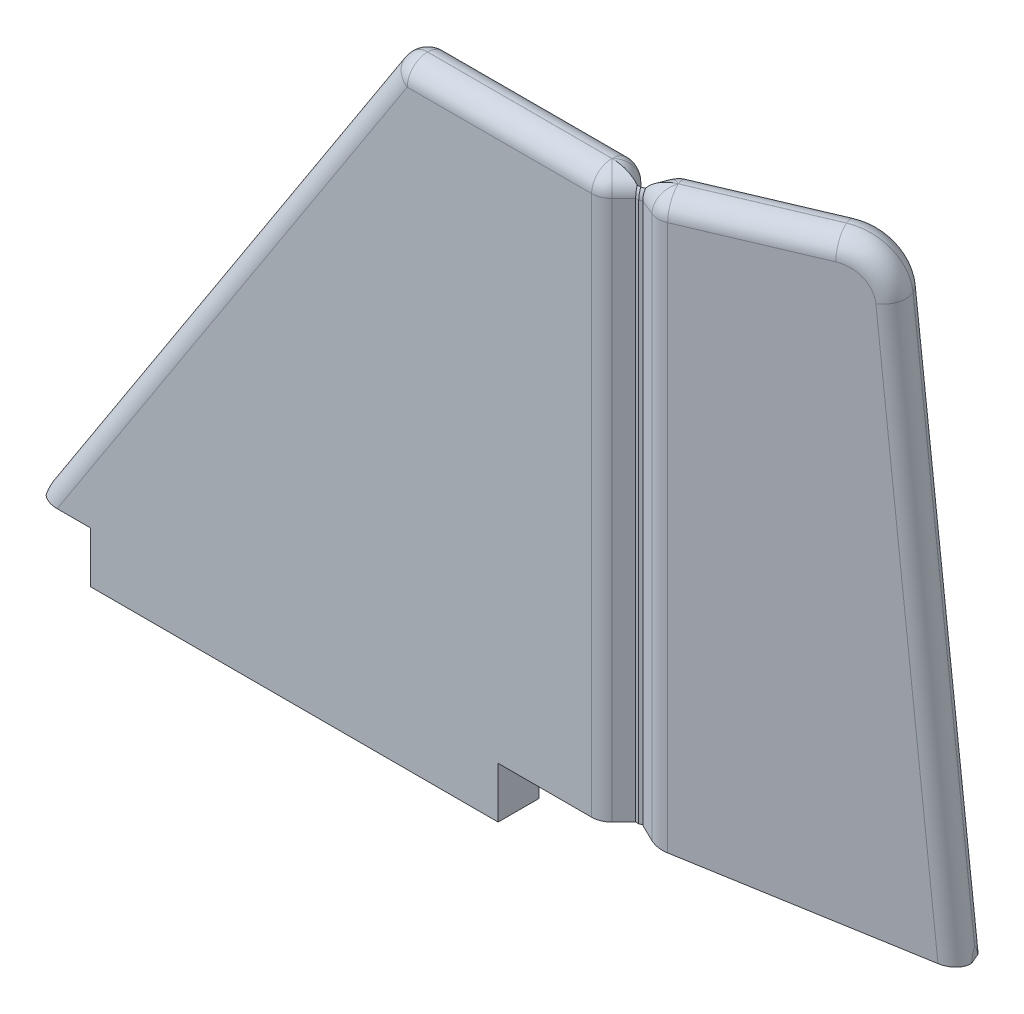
SolidWorks part; units mm, degrees
ref_plane "Plan de face" through (0, 0, 0) normal (0, 0, 1) x (1, 0, 0)
ref_plane "Plan de dessus" through (0, 0, 0) normal (0, 1, 0) x (1, 0, 0)
ref_plane "Plan de droite" through (0, 0, 0) normal (1, 0, 0) x (0, 0, -1)
sketch "Esquisse1" plane through (0, 0, 0) normal (0, 1, 0) x (1, 0, 0)
  line L0 (-66.7162, 0) -> (100.1965, 0) construction
  line L1 (0, -23.9494) -> (0, 66.7162) construction
  line L2 (-57, -25.2419) -> (-57, 46.6455) construction
  line L3 (0, 0) -> (41.9034, 17.787) construction
  line L4 (17.2106, 23.4369) -> (32.8573, -13.4244) construction
  line L5 (8.1991, -19.3158) -> (0, 0) construction
  line L6 (-61.3571, -2) -> (-0.9216, -2) construction
  line L7 (36.5036, 13.3221) -> (1.4959, -1.5377) construction
  line L8 (-61.3571, 2) -> (-0.9216, 2) construction
  line L9 (0.3188, 2.3081) -> (35.6525, 17.3063) construction
  line L10 (1.0043, 0.6979) -> (-0.0509, 0.25) construction
  line L11 (1.3069, 0.2831) -> (0.0509, -0.25) construction
  line L12 (-2.3707, 0.25) -> (-0.0509, 0.25) construction
  line L13 (-2.3707, -0.25) -> (0.0509, -0.25) construction
  line L14 (0.8641, -1.3958) -> (-0.1421, 0.9746) construction
  line L15 (-0.25, -0.25) -> (-2.4272, -2.4272) construction
  line L16 (-0.25, 0.4022) -> (-0.25, -0.7324) construction
  line L17 (0.3278, -0.1324) -> (3.0113, -1.2166) construction
  line L18 (2.6225, -1.0595) -> (0.3278, -0.1324)
  line L19 (0.3278, -0.1324) -> (0.0509, -0.25)
  line L20 (1.0595, 2.6225) -> (0.1324, 0.3278)
  line L21 (-0.25, -0.25) -> (-2, -2)
  line L22 (-0.25, 0.25) -> (-2, 2)
  line L23 (-0.25, -0.25) -> (0.0509, -0.25)
  line L24 (-0.25, 0.25) -> (-0.0509, 0.25)
  line L25 (-0.0509, 0.25) -> (0.1324, 0.3278)
  line L26 (1.0595, 2.6225) -> (22.2312, 11.6093)
  line L27 (22.2312, 11.6093) -> (23.7941, 7.9273)
  line L28 (23.7941, 7.9273) -> (2.6225, -1.0595)
  line L29 (-2, -2) -> (-57, -2)
  line L30 (-57, -2) -> (-57, 2)
  line L31 (-57, 2) -> (-2, 2)
  dimension "D1" = 157
  dimension "D2" = 57
  dimension "D3" = 0.5
  dimension "D4" = 2
  dimension "D5" = 4
  dimension "D6" = 2
  dimension "D7" = 0.5
  dimension "D8" = 0.25
  dimension "D9" = 0.25
  dimension "D10" = 0.25
  dimension "D11" = 0.25
  dimension "D12" = 45
  dimension "D13" = 45
extrude "Boss.-Extru.1" add sketch "Esquisse1" along normal blind 60
sketch "Esquisse2" plane through (0, 0, 2) normal (0, 0, 1) x (1, 0, 0)
  line L0 (-62.5371, 0) -> (29.8808, 0) construction
  line L1 (-62.5371, 5) -> (29.8808, 5) construction
  line L2 (0.3278, -6.0997) -> (0.3278, 63.9991) construction
  line L3 (-63.1652, 60) -> (29.8808, 60) construction
  line L4 (-57, 62.9783) -> (-57, -6.0997) construction
  line L5 (-22, 62.9783) -> (-22, 35.4964) construction
  line L6 (-12, -6.0997) -> (-12, 9.3288) construction
  line L7 (-52, -6.0997) -> (-52, 9.3288) construction
  line L8 (-62.5371, 6) -> (-55.1348, 6) construction
  line L9 (-12, 0) -> (0.3278, 0)
  line L10 (-12, 0) -> (-12, 5)
  line L11 (-12, 5) -> (0.3278, 5)
  line L12 (0.3278, 0) -> (0.3278, 5)
  line L13 (-52, 0) -> (-57, 0)
  line L14 (-52, 0) -> (-52, 5)
  line L15 (-52, 5) -> (-57, 5)
  line L16 (-57, 0) -> (-57, 5)
  line L17 (-57, 6) -> (-22, 60)
  line L18 (-22, 60) -> (-57, 60)
  line L19 (-57, 60) -> (-57, 6)
  dimension "D1" = 5
  dimension "D2" = 35
  dimension "D3" = 40
  dimension "D4" = 5
  dimension "D5" = 1
extrude "Enlèv. mat.-Extru.1" cut sketch "Esquisse2" against normal blind 4
sketch "Esquisse3" plane through (0.7815, 0, 1.841) normal (0.3907, 0, 0.9205) x (0.9205, 0, -0.3907)
  line L0 (26.9814, 0) -> (-5.0985, 0) construction
  line L1 (0, -3.7736) -> (0, 7.276) construction
  line L2 (26.9814, 5) -> (-1.4622, 5) construction
  line L3 (25, -2.8857) -> (25, 63.4494) construction
  line L4 (0, 0) -> (0, 5)
  line L5 (0, 5) -> (25, 0)
  line L6 (25, 0) -> (0, 0)
  line L7 (28.7866, 60) -> (-1.4622, 60) construction
  line L8 (20, 63.4494) -> (20, 45.9437) construction
  line L10 (26.9814, 1) -> (24.2841, 1) construction
  line L11 (25, 1) -> (20, 60)
  line L12 (20, 60) -> (25, 60)
  line L13 (25, 60) -> (25, 1)
  dimension "D1" = 5
  dimension "D2" = 1
  dimension "D3" = 5
extrude "Enlèv. mat.-Extru.2" cut sketch "Esquisse3" against normal blind 4
fillet "Congé1" radius 5 1 edges at (18.4101, 60, -7.8146)
fillet "Congé2" radius 1.99 23 edges at (20.1085, 28.2111, -10.7083) (16.5137, 58.6818, -9.1824) (18.0766, 58.6818, -5.5003) (1.4751, 60, 0.596) (0.1893, 60, 0.1912) (-0.0996, 60, 0.25) (-1.125, 60, 1.125) (-12, 60, 2) (-22, 60, 0) (-12, 60, -2) (-1.125, 60, -1.125) (-0.1504, 60, -0.25) (0.0408, 60, -0.2889) (0.596, 60, -1.4751) (7.2296, 60, -5.2415) (8.7925, 60, -1.5595) (1.0595, 32.3, -2.6225) (-2, 32.5, -2) (-39.5, 33, -2) (2.6225, 32.3, 1.0595) (-2, 32.5, 2) (-39.5, 33, 2) (21.6714, 28.2111, -7.0262)
